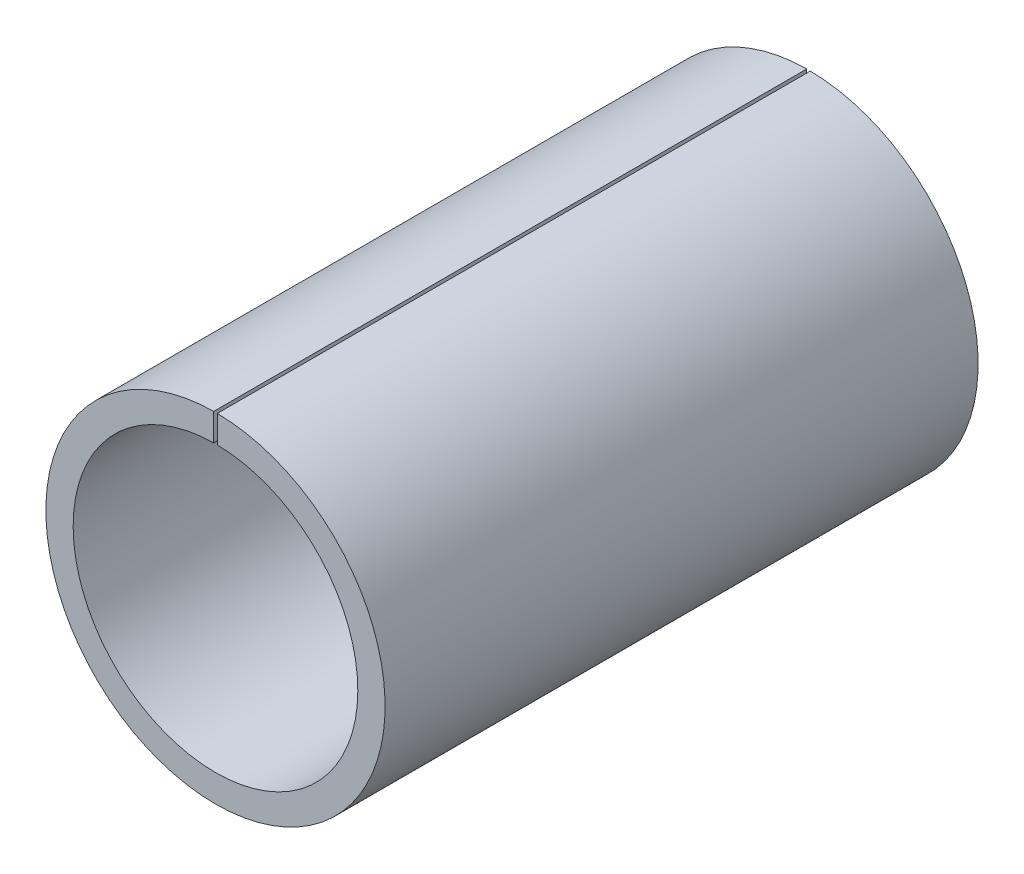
SolidWorks part; units mm, degrees
ref_plane "Face" through (0, 0, 0) normal (0, 0, 1) x (1, 0, 0)
ref_plane "Dessus" through (0, 0, 0) normal (0, 1, 0) x (1, 0, 0)
ref_plane "Droite" through (0, 0, 0) normal (1, 0, 0) x (0, 0, -1)
sketch "Esquisse1" plane through (0, 0, 0) normal (0, 0, 1) x (1, 0, 0)
  circle A0 centre (190, -10) radius 7.15 construction
  circle A1 centre (190, -10) radius 7.15
  circle A2 centre (190, -10) radius 6
  dimension "D1" = 12
extrude "Extrusion1" add sketch "Esquisse1" along normal up to surface (25.5 mm away)
sketch "Esquisse2" plane through (0, 0, 25.5) normal (0, 0, 1) x (1, 0, 0)
  line L0 (190, -10) -> (190, -5.5372) construction
  line L2 (189.925, -2.8504) -> (189.925, -4.0005)
  line L4 (190.075, -2.8504) -> (190.075, -4.0005)
  circle A0 centre (190, -10) radius 6 construction
  arc A1 (190.075, -4.0005) -> (189.925, -4.0005) centre (190, -10) ccw
  circle A2 centre (190, -10) radius 7.15 construction
  arc A3 (190.075, -2.8504) -> (189.925, -2.8504) centre (190, -10) ccw
  dimension "D1" = 0.15
extrude "Extrusion2" cut sketch "Esquisse2" against normal through all
sketch "Esquisse3" plane through (0, 0, 25.5) normal (0, 0, 1) x (1, 0, 0)
  line L2 (189.925, -4.0005) -> (189.925, -2.8504)
  line L3 (190.075, -2.8504) -> (190.075, -4.0005)
  line L4 (189.925, -4.0005) -> (189.925, -2.8504)
  line L5 (190.075, -2.8504) -> (190.075, -4.0005)
  arc A2 (189.925, -4.0005) -> (190.075, -4.0005) centre (190, -10) ccw
  arc A3 (189.925, -2.8504) -> (190.075, -2.8504) centre (190, -10) ccw
  arc A4 (189.925, -4.0005) -> (190.075, -4.0005) centre (190, -10) ccw
  arc A5 (189.925, -2.8504) -> (190.075, -2.8504) centre (190, -10) ccw
  dimension "D1" = 0
extrude "Extrusion3" cut sketch "Esquisse3" against normal blind 0.5
